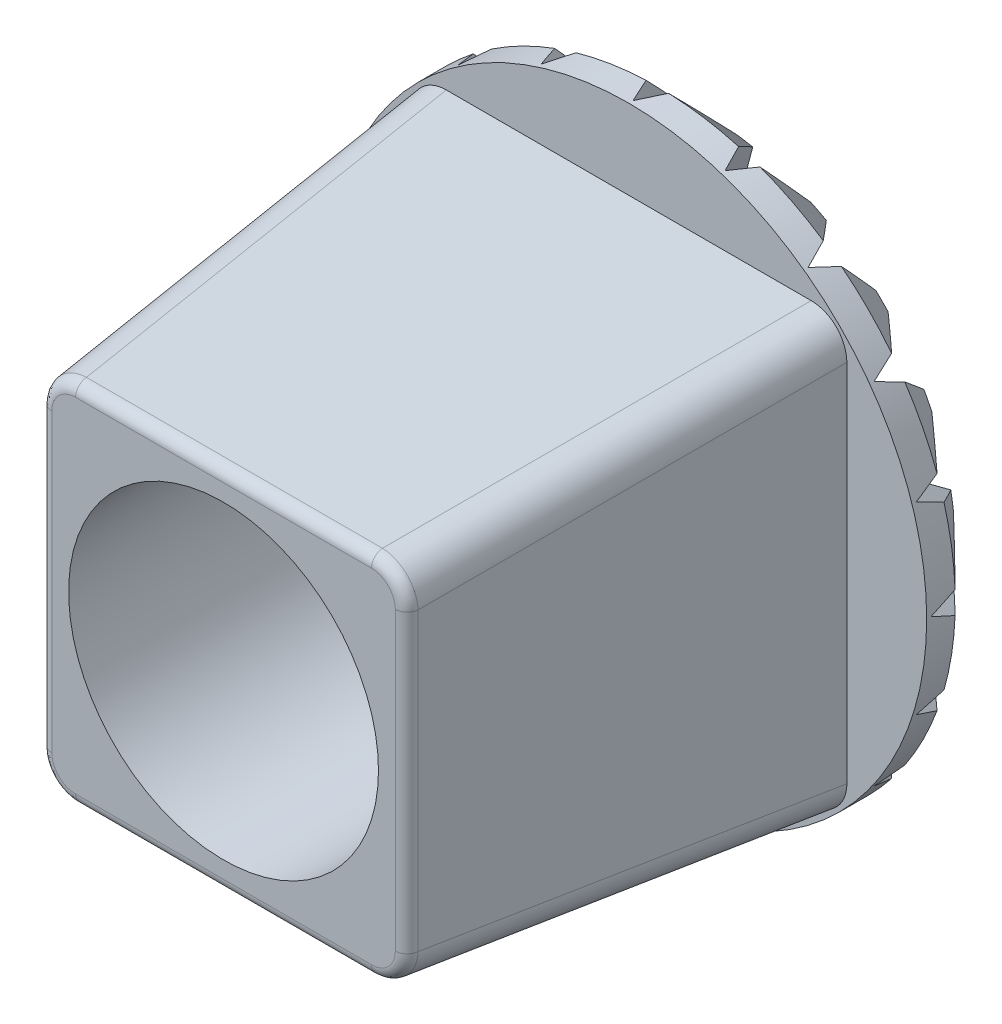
SolidWorks part; units mm, degrees
ref_plane "Plan1" through (0, 0, 0) normal (0, 0, 1) x (1, 0, 0)
ref_plane "Plan2" through (0, 0, 0) normal (0, 1, 0) x (1, 0, 0)
ref_plane "Plan3" through (0, 0, 0) normal (1, 0, 0) x (0, 0, -1)
sketch "Esquisse1" plane through (0, 0, 0) normal (0, 0, 1) x (1, 0, 0)
  line L0 (9.15, 9.15) -> (-9.15, -9.15) construction
  line L1 (-9.15, 9.15) -> (9.15, 9.15)
  line L2 (-9.15, 9.15) -> (-9.15, -9.15)
  line L3 (-9.15, -9.15) -> (9.15, -9.15)
  line L4 (9.15, 9.15) -> (9.15, -9.15)
  line L5 (-9.15, 9.15) -> (7.5, -7.5) construction
  dimension "D1" = 18.3
extrude "Base-Extrusion" add sketch "Esquisse1" along normal blind 17 draft 5
fillet "Congé5" radius 1.5
sketch "Esquisse4" plane through (0, 0, 0) normal (0, 0, -1) x (-1, 0, 0)
  circle A0 centre (0, 0) radius 12.5
  dimension "D1" = 25
extrude "Boss.-Extru.1" add sketch "Esquisse4" along normal blind 3.2
hole_wizard "Perçage1" positions "Esquisse3" profile "Esquisse2" counterbore size "M8" standard "ISO"
sketch "Esquisse3" plane through (0, 0, 17) normal (0, 0, 1) x (1, 0, 0)
  point P0 (0, 0)
sketch "Esquisse2" plane through (0, 0, 17) normal (1, 0, 0) x (0, -1, 0)
  line L0 (0, 0) -> (0, 20.2)
  line L1 (0, 20.2) -> (4.4, 20.2)
  line L3 (4.4, 20.2) -> (4.4, 10)
  line L4 (4.4, 10) -> (6.5, 10)
  line L5 (6.5, 10) -> (6.5, 0)
  line L7 (6.5, 0) -> (0, 0)
  line L11 (0, -6.35) -> (0, 107.95) construction
  dimension "Diamètre du perçage jusqu'au prochain" = 8.8
  dimension "Profondeur du perçage jusqu'au prochain" = 20.2
  dimension "Diamètre du chambrage" = 13
  dimension "Profondeur du chambrage" = 10
sketch "Esquisse5" plane through (0, 0, -3.2) normal (0, 0, -1) x (-1, 0, 0)
  line L0 (-12.5, 12) -> (-12.5, -12) construction
  circle A0 centre (0, 0) radius 4.5
  circle A1 centre (0, 0) radius 12.5 construction
  dimension "D1" = 9
extrude "Enlèv. mat.-Extru.1" cut sketch "Esquisse5" against normal blind 2
ref_plane "Plan4" through (11.9273, 0, 1.4645) normal (-0.9925, 0, -0.1219) x (-0.1219, 0, 0.9925)
sketch "Esquisse6" plane through (11.9273, 0, 1.4645) normal (-0.9925, 0, -0.1219) x (-0.1219, 0, 0.9925)
  line L0 (-4.6995, 7.6254) -> (-4.6995, -6.3746) construction
  line L1 (-5.6995, -1.8652) -> (-5.6995, 1.8652)
  line L2 (-4.6995, 0) -> (10.6171, 0) construction
  line L4 (-5.6995, 1.8652) -> (-1.6995, 0)
  line L5 (-5.6995, -1.8652) -> (-1.6995, 0)
  ellipse E0 centre (-3.1761, 0) end of major axis (-3.1761, 12.5) minor radius 1.5234 construction
  point P14 (-5.6995, 0)
  dimension "D1" = 50
  dimension "D2" = 3
  dimension "D3" = 1
extrude "Enlèv. mat.-Extru.2" cut sketch "Esquisse6" along normal blind 12.5 and the other way through all
chamfer "Chanfrein1" distance 2 angle 45
pattern_circular "Répétition circulaire1" count 20 over 360
fillet "Congé6" radius 0.5
